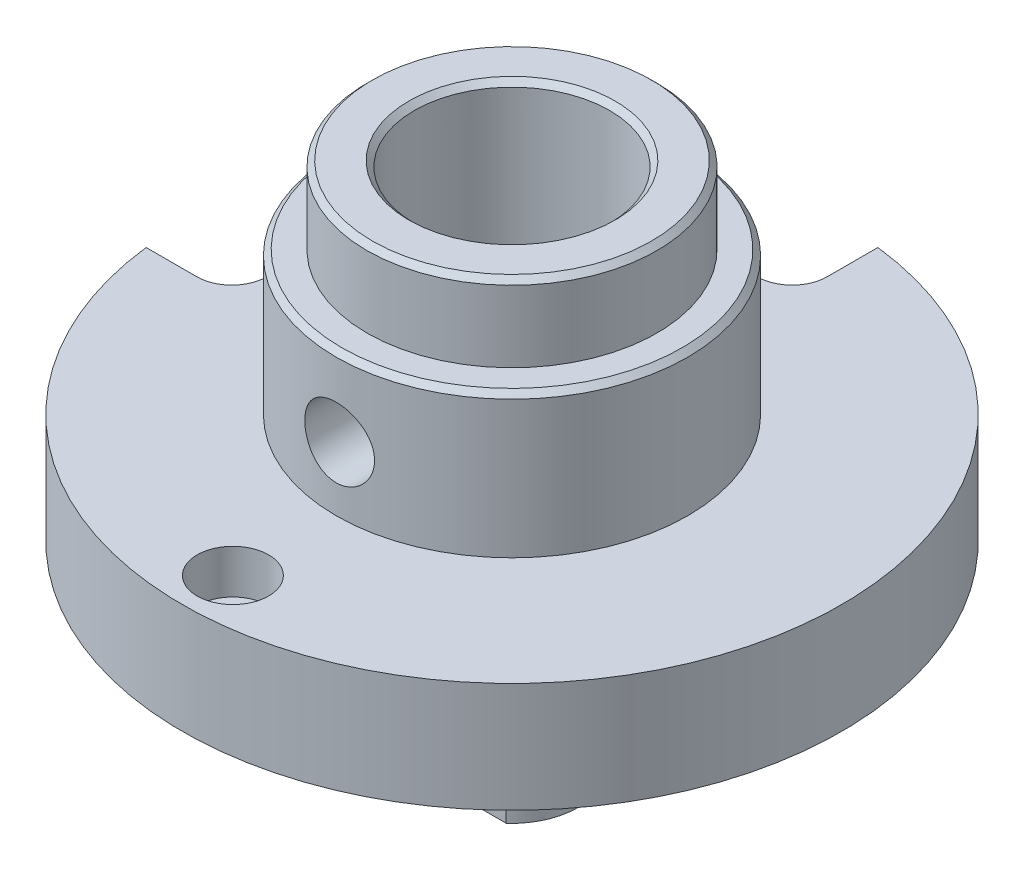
SolidWorks part; units mm, degrees
ref_plane "Front Plane" through (0, 0, 0) normal (0, 0, 1) x (1, 0, 0)
ref_plane "Top Plane" through (0, 0, 0) normal (0, 1, 0) x (1, 0, 0)
ref_plane "Right Plane" through (0, 0, 0) normal (1, 0, 0) x (0, 0, -1)
ref_axis "Axis1" through (0, -70.5, 0) along (0, 1, 0)
sketch "Sketch1" plane through (0, 0, 0) normal (0, 0, 1) x (1, 0, 0)
  line L0 (6.6, 15) -> (6.6, 11.5)
  line L1 (6.6, 15) -> (4.445, 15)
  line L2 (0, -55) -> (0, 55) construction
  line L3 (0, 2.5) -> (0, -9)
  line L4 (0, -9) -> (3, -9)
  line L5 (3, -9) -> (3, 0)
  line L6 (55, 0) -> (-55, 0) construction
  line L7 (3, 0) -> (15, 0)
  line L8 (15, 0) -> (15, 5)
  line L9 (15, 5) -> (8, 5)
  line L10 (8, 5) -> (8, 11.5)
  line L11 (6.6, 11.5) -> (8, 11.5)
  line L12 (4.445, 15) -> (4.445, 3)
  line L25 (3.945, 2.5) -> (0, 2.5)
  line L26 (0, -31.4075) -> (0, 31.4075) construction
  arc A0 (4.445, 3) -> (3.945, 2.5) centre (3.945, 3) cw
  point P30 (0, 0)
  dimension "D17" = 0.5
  dimension "D3" = 5
  dimension "D4" = 11.5
  dimension "D5" = 30
  dimension "D6" = 13.2
  dimension "D7" = 9
  dimension "D8" = 6
  dimension "D10" = 15
  dimension "D13" = 8.89
  dimension "D15" = 2.5
  dimension "D16" = 16
revolve "Revolve1" add sketch "Sketch1" angle 360 about axis through (0, -70.5, 0) along (0, 1, 0)
sketch "Sketch2" plane through (0, 0, 0) normal (0, 0, 1) x (1, 0, 0)
  line L0 (0, -13.2633) -> (0, 13.2633) construction
  circle A0 centre (0, 7.89) radius 1.5875
  dimension "D2" = 3.175
  dimension "D1" = 7.89
extrude "Cut-Extrude1" cut sketch "Sketch2" against normal through all
sketch "Sketch8" plane through (0, 0, 0) normal (0, 0, 1) x (1, 0, 0)
  circle A0 centre (0, 7.89) radius 1.5875
  dimension "D1" = 3.175
extrude "Cut-Extrude7" cut sketch "Sketch8" along normal through all
sketch "Sketch3" plane through (0, 5, 0) normal (0, 1, 0) x (1, 0, 0)
  circle A1 centre (0, -12.7) radius 0.5
  dimension "D3" = 1
  dimension "D4" = 12.7
extrude "Cut-Extrude2" cut sketch "Sketch3" against normal through all
sketch "Sketch4" plane through (0, 5, 0) normal (0, 1, 0) x (1, 0, 0)
  circle A1 centre (0, -12.7) radius 1.6256
  dimension "D2" = 3.2512
extrude "Cut-Extrude3" cut sketch "Sketch4" against normal blind 2
sketch "Sketch5" plane through (0, -9, 0) normal (0, -1, 0) x (1, 0, 0)
  line L0 (-1.9843, 2.25) -> (1.9843, 2.25)
  line L3 (0, 0) -> (0, 2.25) construction
  circle A0 centre (0, 0) radius 3 construction
  arc A1 (-1.9843, 2.25) -> (1.9843, 2.25) centre (0, 0) cw
  dimension "D1" = 2.25
extrude "Cut-Extrude4" cut sketch "Sketch5" against normal blind 7
sketch "Sketch6" plane through (0, 5, 0) normal (0, 1, 0) x (1, 0, 0)
  line L0 (1.75, 14.8976) -> (1.75, 11)
  line L1 (-14.8976, -1.75) -> (-11, -1.75)
  line L2 (0, 11) -> (1.75, 11)
  line L3 (-11, 0) -> (-11, -1.75)
  arc A0 (1.75, 14.8976) -> (-14.8976, -1.75) centre (0, 0) ccw
  arc A1 (0, 11) -> (-11, 0) centre (0, 0) ccw
  dimension "D1" = 30
  dimension "D4" = 1.75
  dimension "D2" = 22
  dimension "D3" = 1.75
extrude "Cut-Extrude5" cut sketch "Sketch6" against normal up to next
chamfer "Chamfer3" distance 0.25 angle 45 3 edges at (0, 15, -6.6) (0, 11.5, -8) (0, 15, -4.445)
fillet "Fillet2" radius 1.5875 1 edges at (0, 0, -3)
hole_wizard "#4-40 Tapped Hole1" positions "Sketch9" profile "Sketch10" tap size "#4-40" standard "ANSI Inch"
sketch "Sketch9" plane through (0, 5, 0) normal (0, -1, 0) x (-1, 0, 0)
  point P0 (0, -12.7)
sketch "Sketch10" plane through (0, 5, 12.7) normal (1, 0, 0) x (0, 0, 1)
  line L0 (0, 0) -> (0, 14)
  line L1 (0, 14) -> (1.1303, 14)
  line L2 (1.1303, 14) -> (1.1303, 0)
  line L5 (1.1303, 0) -> (0, 0)
  line L11 (0, -6.35) -> (0, 107.95) construction
  dimension "Thru Tap Drill Dia." = 2.2606
  dimension "Thru Tap Drill Depth" = 14
fillet "Fillet3" radius 1.5875 2 edges at (-11, 2.5, 1.75) (1.75, 2.5, -11)
